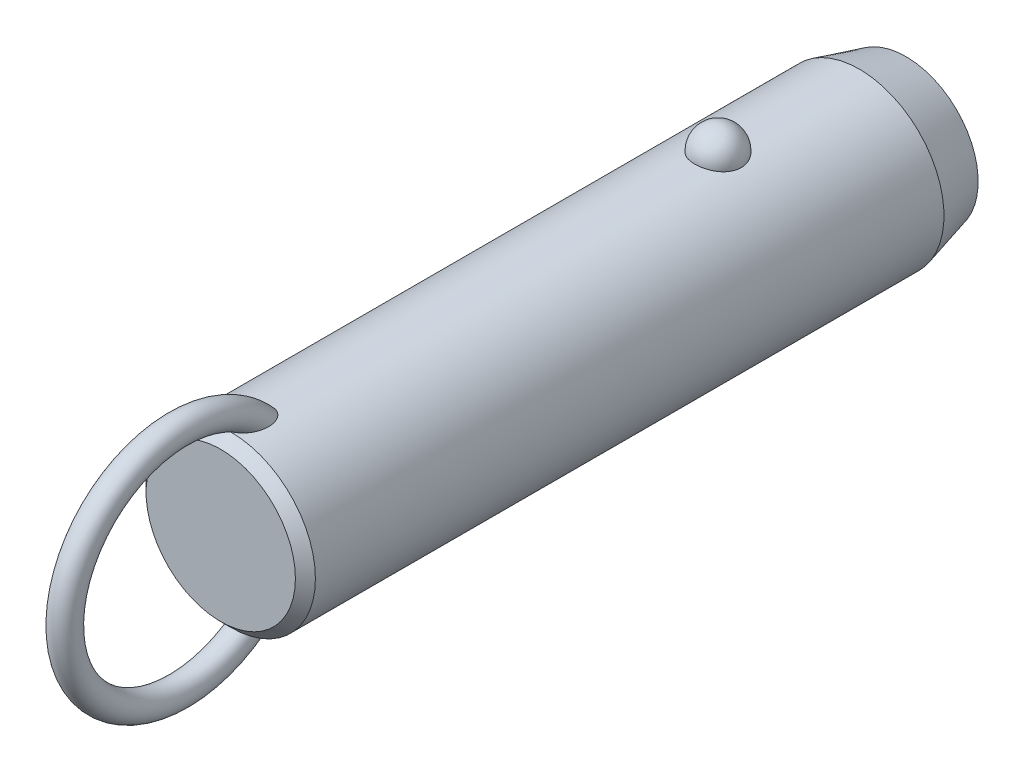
SolidWorks part; units mm, degrees
ref_plane "Front Plane" through (0, 0, 0) normal (0, 0, 1) x (1, 0, 0)
ref_plane "Top Plane" through (0, 0, 0) normal (0, 1, 0) x (1, 0, 0)
ref_plane "Right Plane" through (0, 0, 0) normal (1, 0, 0) x (0, 0, -1)
sketch "Sketch2" plane through (0, 0, 0) normal (0, 0, 1) x (1, 0, 0)
  circle A0 centre (0, 0) radius 12.7
  point P3 (0, 12.7)
  dimension "D1" = 25.4
extrude "Boss-Extrude1" add sketch "Sketch2" along normal blind 58.4
sketch "Sketch3" plane through (0, 0, 0) normal (0, 0, -1) x (-1, 0, 0)
  circle A0 centre (0, 0) radius 12.7
  dimension "D1" = 25.4
extrude "Boss-Extrude2" add sketch "Sketch3" along normal blind 31.7
chamfer "Chamfer1" distance 7 angle 15 1 edges at (-12.7, 0, -31.7)
sketch "Sketch12" plane through (0, 0, 0) normal (1, 0, 0) x (0, 0, -1)
  line L0 (-58.4, 12.7) -> (-58.4, -12.7) construction
  point P0 (-58.4, 0)
sketch "Sketch13" plane through (0, 0, 0) normal (1, 0, 0) x (0, 0, -1)
  circle A0 centre (-77.45, 0) radius 19.05
  point P2 (-58.4, 0)
  dimension "D1" = 38.1
sketch "Sketch14" plane through (0, 0, 0) normal (0, 1, 0) x (1, 0, 0)
  circle A0 centre (0, -60.4) radius 2
  point P2 (0, -58.4)
  dimension "D1" = 4
sweep "Sweep1" add profiles "Sketch14" path "Sketch13"
sketch "Sketch15" plane through (0, 0, 58.4) normal (0, 0, 1) x (1, 0, 0)
  circle A0 centre (0, 0) radius 12.7
  dimension "D1" = 25.4
extrude "Boss-Extrude3" add sketch "Sketch15" along normal blind 12.7
chamfer "Chamfer2" distance 1.5 angle 45 1 edges at (12.7, 0, 71.1)
sketch "Sketch18" plane through (0, 0, 0) normal (1, 0, 0) x (0, 0, -1)
  line L0 (24.7, 12.7) -> (-63.251, 12.7) construction
  line L1 (3.5, 16.2) -> (3.5, 9.2)
  line L2 (-63.251, -12.7) -> (24.7, -12.7) construction
  arc A0 (3.5, 16.2) -> (3.5, 9.2) centre (3.5, 12.7) ccw
  point P4 (0, 12.7)
  dimension "D1" = 28.9
revolve "Revolve1" add sketch "Sketch18" angle 360 about L1
